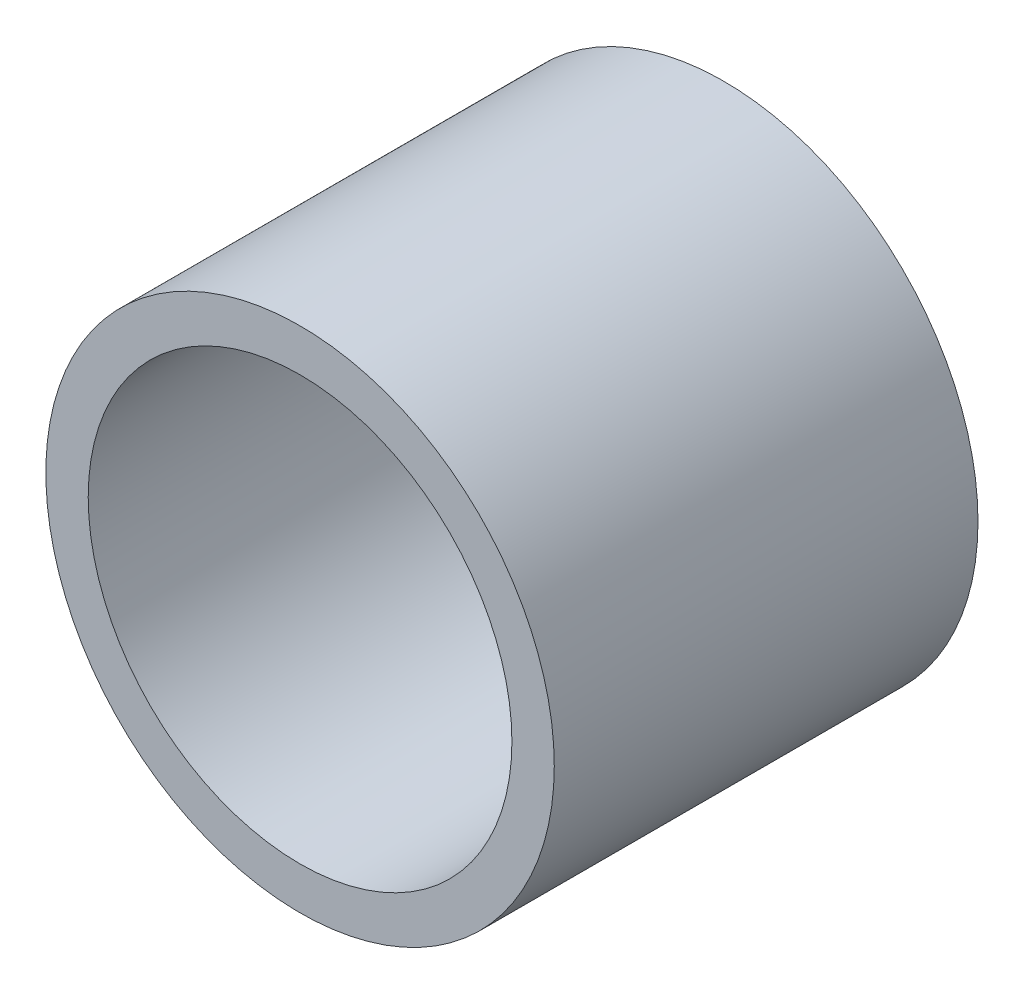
SolidWorks part; units mm, degrees
ref_plane "Plan de face" through (0, 0, 0) normal (0, 0, 1) x (1, 0, 0)
ref_plane "Plan de dessus" through (0, 0, 0) normal (0, 1, 0) x (1, 0, 0)
ref_plane "Plan de droite" through (0, 0, 0) normal (1, 0, 0) x (0, 0, -1)
sketch "Esquisse1" plane through (0, 0, 0) normal (0, 0, 1) x (1, 0, 0)
  circle A0 centre (0, 0) radius 5
  circle A1 centre (0, 0) radius 6
  dimension "D1" = 10
  dimension "D2" = 12
extrude "Extrusion2" add sketch "Esquisse1" along normal blind 10
